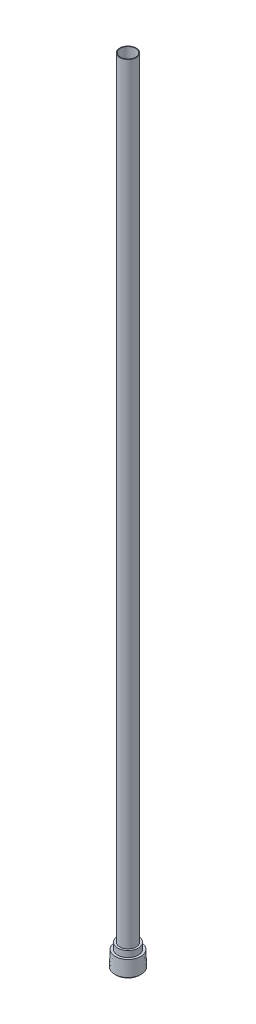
SolidWorks part; units mm, degrees
ref_plane "Front Plane" through (0, 0, 0) normal (0, 0, 1) x (1, 0, 0)
ref_plane "Top Plane" through (0, 0, 0) normal (0, 1, 0) x (1, 0, 0)
ref_plane "Right Plane" through (0, 0, 0) normal (1, 0, 0) x (0, 0, -1)
sketch "Sketch1" plane through (0, 0, 0) normal (1, 0, 0) x (0, 0, -1)
  line L0 (0, 304.8) -> (0, 0)
  line L1 (3.9624, 6.35) -> (3.9624, 8.7122)
  line L2 (3.9624, 8.7122) -> (3.175, 8.7122)
  line L5 (5.0927, 0) -> (4.8612, 6.35)
  line L6 (0, 0) -> (5.0927, 0)
  line L7 (4.8612, 6.35) -> (3.9624, 6.35)
  line L8 (3.175, 8.7122) -> (3.175, 304.8)
  line L9 (3.175, 304.8) -> (0, 304.8)
  line L10 (0, 0) -> (0, -49989.3417) construction
  dimension "D1" = 2.088
  dimension "PH" = 6.35
  dimension "L" = 304.8
  dimension "OD" = 6.35
  dimension "NPT" = 10.1854
  dimension "SH-D" = 7.9248
  dimension "SH" = 8.7122
revolve "Revolve1" add sketch "Sketch1" angle 360 about L10
sketch "Sketch3" plane through (0, 0, 0) normal (0, -1, 0) x (-1, 0, 0)
  line L0 (0, 5.5823) -> (0, -5.5823) construction
  line L1 (0, -2.7423) -> (2.3749, -1.3711)
  line L2 (2.3749, -1.3711) -> (2.3749, 1.3711)
  line L3 (2.3749, 1.3711) -> (0, 2.7423)
  line L4 (0, 2.7423) -> (-2.3749, 1.3711)
  line L5 (-2.3749, 1.3711) -> (-2.3749, -1.3711)
  line L6 (-2.3749, -1.3711) -> (0, -2.7423)
  circle A0 centre (0, 0) radius 2.3749 construction
  dimension "HEX" = 4.7498
extrude "Cut-Extrude2" cut sketch "Sketch3" against normal blind 4.7498
sketch "Sketch2" plane through (0, 304.8, 0) normal (0, 1, 0) x (1, 0, 0)
  circle A0 centre (0, 0) radius 2.921
  dimension "ID" = 5.842
extrude "Cut-Extrude1" cut sketch "Sketch2" against normal up to surface (300.0502 mm away)
chamfer "Chamfer1" distance 0.508 angle 45 1 edges at (0, 0, 5.0927)
